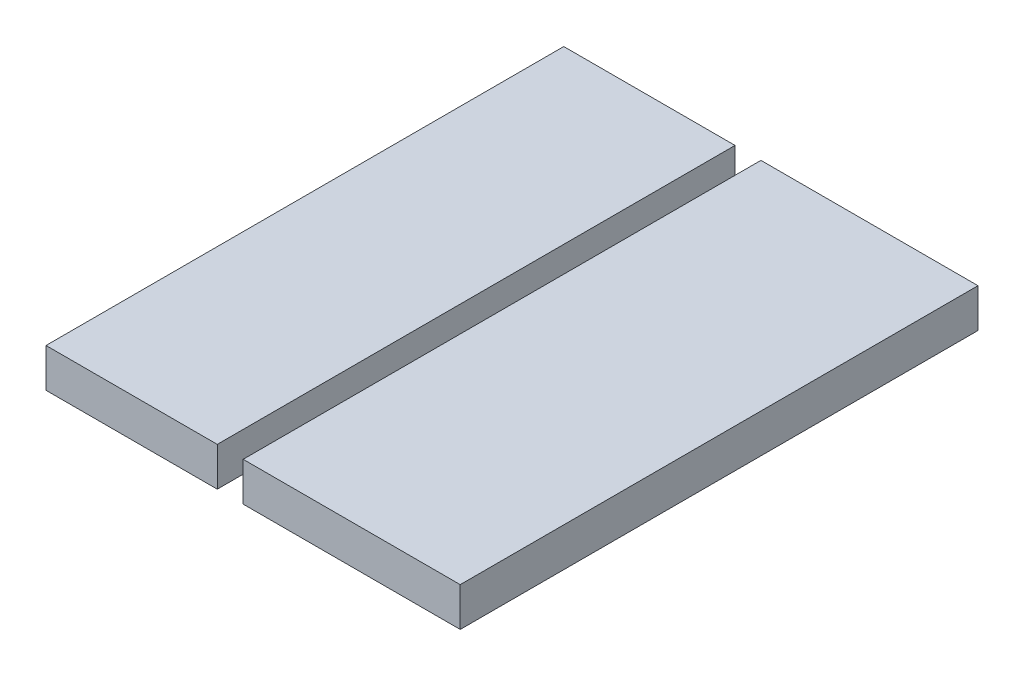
SolidWorks part; units mm, degrees
ref_plane "Front Plane" through (0, 0, 0) normal (0, 0, 1) x (1, 0, 0)
ref_plane "Top Plane" through (0, 0, 0) normal (0, 1, 0) x (1, 0, 0)
ref_plane "Right Plane" through (0, 0, 0) normal (1, 0, 0) x (0, 0, -1)
ref_plane "Plane2" through (0, 0, 0) normal (0, -1, 0) x (1, 0, 0)
sketch "Sketch5" plane through (0, 0, 0) normal (0, -1, 0) x (1, 0, 0)
  line L0 (1.5875, 40.3951) -> (1.5875, -23.1049)
  line L1 (1.5875, -23.1049) -> (28.2086, -23.1049)
  line L2 (28.2086, -23.1049) -> (28.2086, 40.3951)
  line L3 (28.2086, 40.3951) -> (1.5875, 40.3951)
extrude "Boss-Extrude2" add sketch "Sketch5" against normal blind 4.7625 separate body
ref_plane "Plane3" through (0, 4.7625, 0) normal (0, 1, 0) x (-1, 0, 0)
sketch "Sketch10" plane through (0, 4.7625, 0) normal (0, 1, 0) x (-1, 0, 0)
  line L0 (22.5914, 40.3951) -> (1.5875, 40.3951)
  line L1 (1.5875, 40.3951) -> (1.5875, -23.1049)
  line L2 (1.5875, -23.1049) -> (22.5914, -23.1049)
  line L3 (22.5914, -23.1049) -> (22.5914, 40.3951)
extrude "Boss-Extrude3" add sketch "Sketch10" against normal blind 4.7625 separate body
